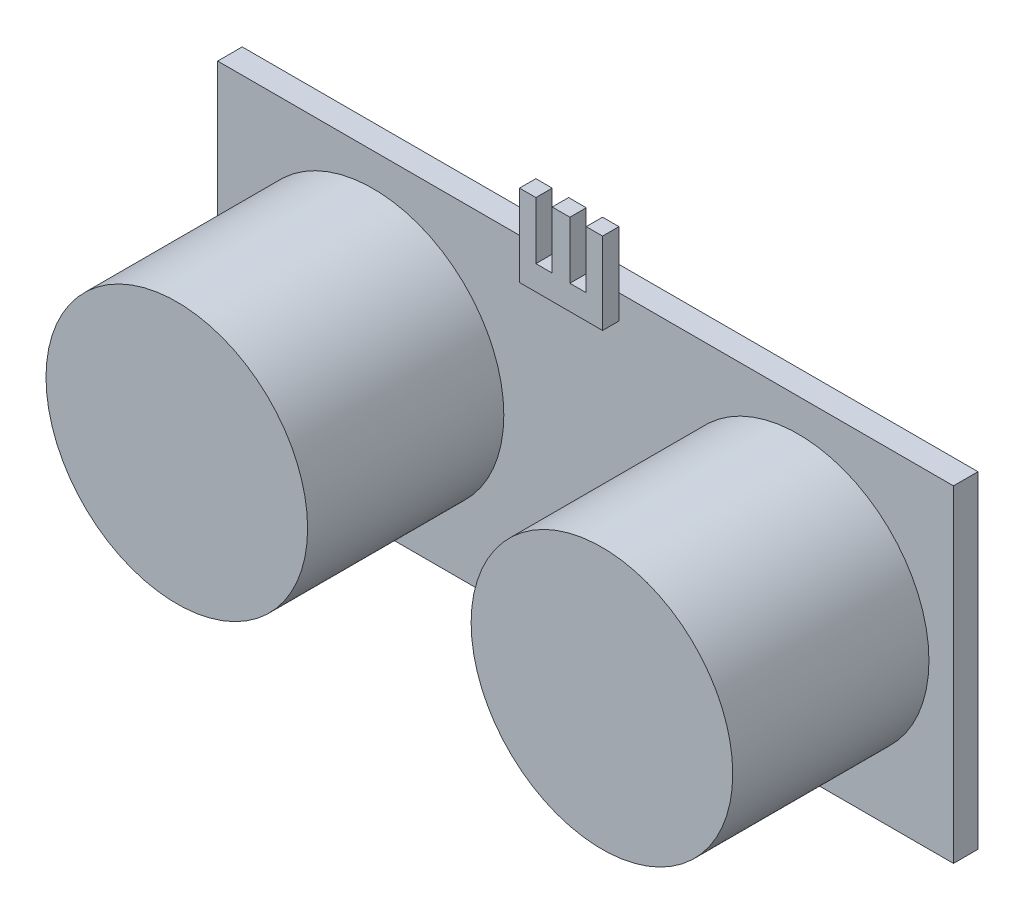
SolidWorks part; units mm, degrees
ref_plane "Front Plane" through (0, 0, 0) normal (0, 0, 1) x (1, 0, 0)
ref_plane "Top Plane" through (0, 0, 0) normal (0, 1, 0) x (1, 0, 0)
ref_plane "Right Plane" through (0, 0, 0) normal (1, 0, 0) x (0, 0, -1)
sketch "Sketch1" plane through (0, 0, 0) normal (0, 0, 1) x (1, 0, 0)
  line L1 (-22.5, 10) -> (22.5, 10)
  line L2 (-22.5, 10) -> (-22.5, -10)
  line L3 (-22.5, -10) -> (22.5, -10)
  line L4 (22.5, 10) -> (22.5, -10)
  line L5 (-22.5, 10) -> (22.5, -10) construction
  line L6 (-22.5, -10) -> (22.5, 10) construction
  point P0 (0, 0)
  dimension "D1" = 45
  dimension "D2" = 20
extrude "Boss-Extrude1" add sketch "Sketch1" along normal blind 1.5
sketch "Sketch2" plane through (0, 0, 1.5) normal (0, 0, 1) x (1, 0, 0)
  circle A0 centre (-13, 0) radius 8
  circle A1 centre (13, 0) radius 8
  dimension "D1" = 16
  dimension "D2" = 16
  dimension "D3" = 13
  dimension "D4" = 13
extrude "Boss-Extrude2" add sketch "Sketch2" along normal blind 12
sketch "Sketch3" plane through (0, 0, 1.5) normal (0, 0, 1) x (1, 0, 0)
  line L0 (-22.5, 10) -> (-22.5, -10) construction
  line L1 (-3.04, 13.5) -> (2.04, 13.5)
  line L2 (-3.04, 13.5) -> (-3.04, 8.5)
  line L3 (-3.04, 8.5) -> (2.04, 8.5)
  line L4 (2.04, 13.5) -> (2.04, 8.5)
  line L5 (-3.04, 13.5) -> (2.04, 8.5) construction
  line L6 (-3.04, 8.5) -> (2.04, 13.5) construction
  point P0 (-0.5, 11)
  point P5 (0, 0)
  point P8 (-13.3341, 10.5714)
  dimension "D1" = 5.08
  dimension "D2" = 5
  dimension "D3" = 11
  dimension "D4" = 22
extrude "Boss-Extrude3" add sketch "Sketch3" along normal blind 1
sketch "Sketch4" plane through (0, 0, 1.5) normal (0, 0, -1) x (-1, 0, 0)
  line L0 (-22.5, 10) -> (22.5, 10) construction
  line L1 (-1.04, 10) -> (-0.04, 10)
  line L2 (-1.04, 10) -> (-1.04, 13.5)
  line L3 (-1.04, 13.5) -> (-0.04, 13.5)
  line L4 (-0.04, 10) -> (-0.04, 13.5)
  line L5 (-2.04, 13.5) -> (3.04, 13.5) construction
  line L6 (-2.04, 10) -> (3.04, 10) construction
  line L7 (1.04, 10) -> (2.04, 10)
  line L8 (1.04, 10) -> (1.04, 13.5)
  line L9 (1.04, 13.5) -> (2.04, 13.5)
  line L10 (2.04, 10) -> (2.04, 13.5)
  line L11 (3.04, 13.5) -> (3.04, 10) construction
  line L12 (-2.04, 10) -> (-2.04, 13.5) construction
  dimension "D1" = 1
  dimension "D2" = 1
  dimension "D3" = 1
  dimension "D4" = 1
extrude "Cut-Extrude1" cut sketch "Sketch4" against normal blind 1
